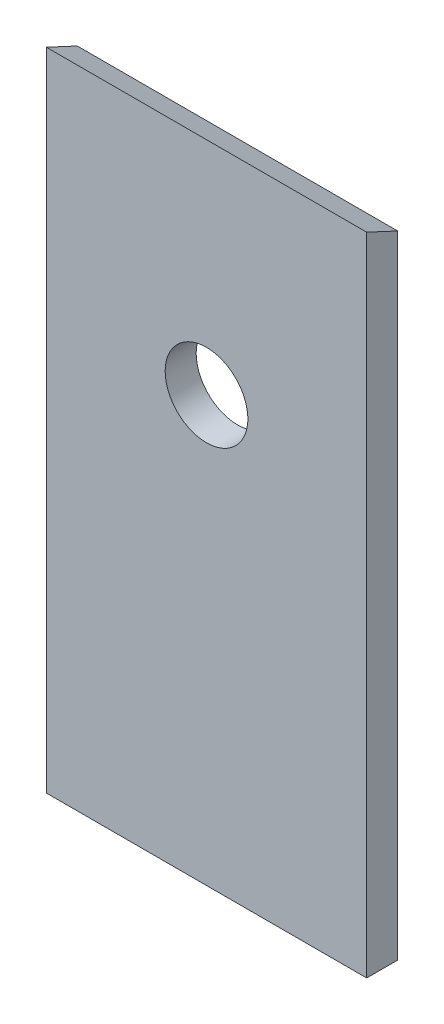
SolidWorks part; units mm, degrees
ref_plane "Plan de face" through (0, 0, 0) normal (0, 0, 1) x (1, 0, 0)
ref_plane "Plan de dessus" through (0, 0, 0) normal (0, 1, 0) x (1, 0, 0)
ref_plane "Plan de droite" through (0, 0, 0) normal (1, 0, 0) x (0, 0, -1)
sketch "Esquisse1" plane through (0, 0, 0) normal (1, 0, 0) x (0, 0, -1)
  line L0 (12, 244.4043) -> (0, 244.4043) construction
  line L1 (0, 0) -> (12, 0)
  line L2 (0, 0) -> (0, 250)
  line L3 (0, 250) -> (12, 244.4043)
  line L4 (12, 0) -> (12, 244.4043)
  point P5 (0, 0)
  point P7 (-5.1016, 195.6054)
  point P8 (0, 195.6054)
  dimension "D1" = 250
  dimension "D2" = 12
  dimension "D3" = 25
extrude "Boss.-Extru.1" add sketch "Esquisse1" along normal blind 124 contours L4 L3 L2 L1
sketch "Esquisse2" plane through (0, 0, -12) normal (0, 0, -1) x (-1, 0, 0)
  line L2 (-62, 244.4043) -> (-62, 0) construction
  line L5 (-124, 244.4043) -> (0, 244.4043) construction
  line L6 (-124, 0) -> (0, 0) construction
  circle A0 centre (-62, 164.4043) radius 16
  point P2 (0, 0)
  dimension "D2" = 32
  dimension "D1" = 80
extrude "Enlèv. mat.-Extru.1" cut sketch "Esquisse2" along direction (0, 0, 1) on the side against the normal through all
